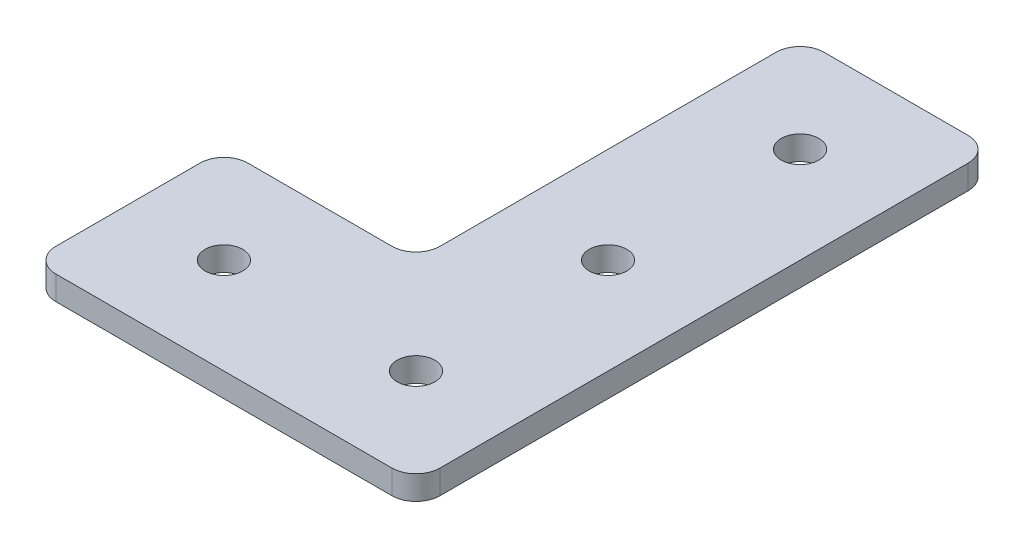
SolidWorks part; units mm, degrees
ref_plane "Front Plane" through (0, 0, 0) normal (0, 0, 1) x (1, 0, 0)
ref_plane "Top Plane" through (0, 0, 0) normal (0, 1, 0) x (1, 0, 0)
ref_plane "Right Plane" through (0, 0, 0) normal (1, 0, 0) x (0, 0, -1)
sketch "Sketch1" plane through (0, 0, 0) normal (0, 1, 0) x (1, 0, 0)
  line L0 (0, 0) -> (0, 50.8)
  line L1 (0, 50.8) -> (25.4, 50.8)
  line L2 (25.4, 50.8) -> (25.4, -25.4)
  line L3 (25.4, -25.4) -> (-25.4, -25.4)
  line L4 (-25.4, -25.4) -> (-25.4, 0)
  line L5 (-25.4, 0) -> (0, 0)
  line L6 (-25.4, -12.7) -> (25.4, -12.7) construction
  line L7 (12.7, 50.8) -> (12.7, -25.4) construction
  circle A0 centre (12.7, -12.7) radius 2.4892
  circle A1 centre (-12.7, -12.7) radius 2.4892
  circle A2 centre (12.7, 12.7) radius 2.4892
  circle A3 centre (12.7, 38.1) radius 2.4892
  dimension "D4" = 4.9784
  dimension "D2" = 25.4
  dimension "D8" = 12.7
  dimension "D1" = 25.4
  dimension "D3" = 50.8
  dimension "D5" = 12.7
  dimension "D6" = 25.4
  dimension "D7" = 12.7
extrude "Boss-Extrude1" add sketch "Sketch1" along normal blind 3.175
fillet "Fillet1" radius 3.175 6 edges at (25.4, 1.5875, 25.4) (25.4, 1.5875, -50.8) (0, 1.5875, -50.8) (0, 1.5875, 0) (-25.4, 1.5875, 0) (-25.4, 1.5875, 25.4)
